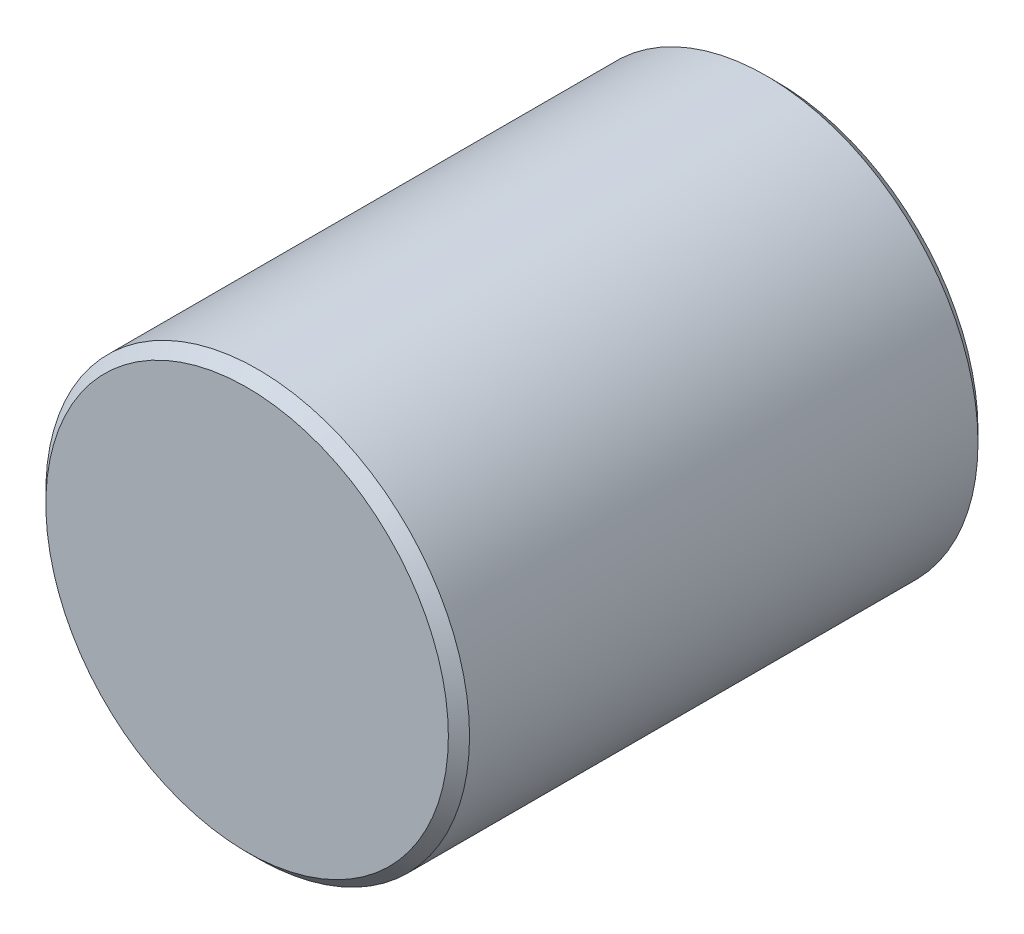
SolidWorks part; units mm, degrees
ref_plane "Front Plane" through (0, 0, 0) normal (0, 0, 1) x (1, 0, 0)
ref_plane "Top Plane" through (0, 0, 0) normal (0, 1, 0) x (1, 0, 0)
ref_plane "Right Plane" through (0, 0, 0) normal (1, 0, 0) x (0, 0, -1)
sketch "Sketch1" plane through (0, 0, 0) normal (0, 0, 1) x (1, 0, 0)
  circle A0 centre (0, 0) radius 50.8
extrude "Extrude1" add sketch "Sketch1" along normal blind 127
chamfer "Chamfer1" distance 2.54 angle 45 2 edges at (50.8, 0, 0) (50.8, 0, 127)
